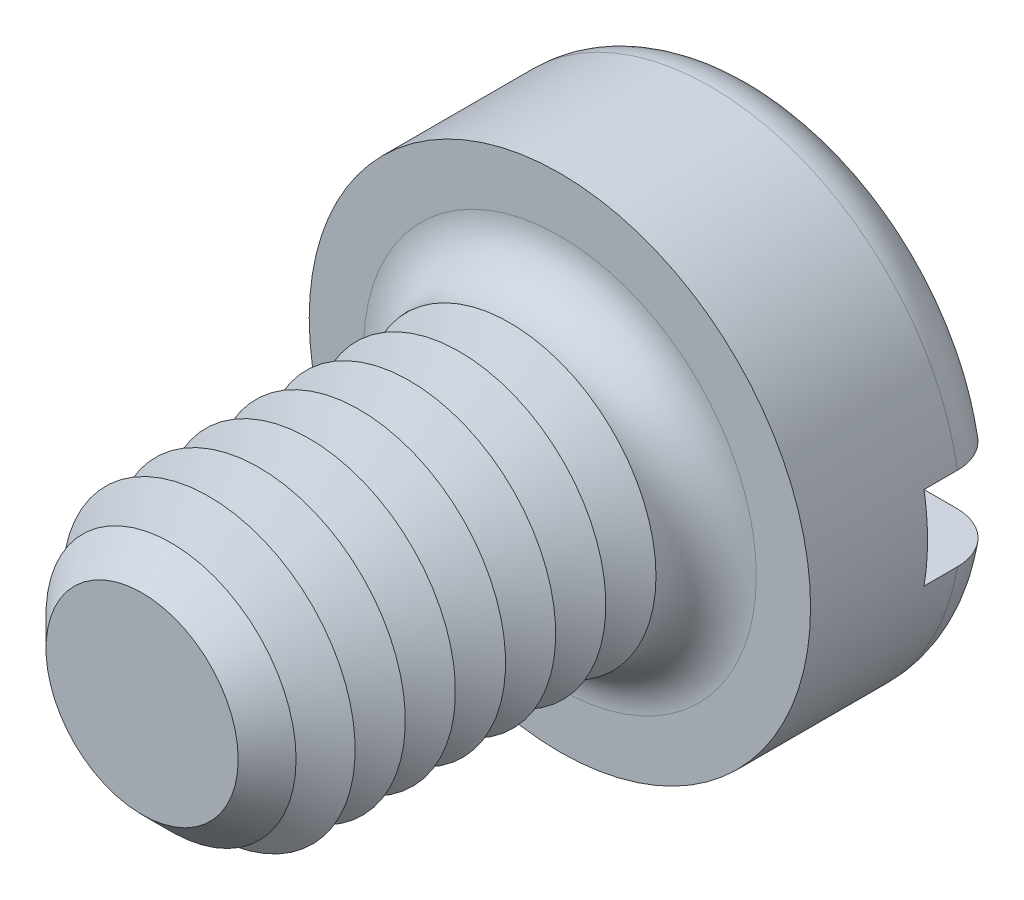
SolidWorks part; units mm, degrees
ref_plane "Front Plane" through (0, 0, 0) normal (0, 0, 1) x (1, 0, 0)
ref_plane "Top Plane" through (0, 0, 0) normal (0, 1, 0) x (1, 0, 0)
ref_plane "Right Plane" through (0, 0, 0) normal (1, 0, 0) x (0, 0, -1)
sketch "Sketch3" plane through (0, 0, 0) normal (0, 0, 1) x (1, 0, 0)
  circle A0 centre (0, 0) radius 3
  dimension "D1" = 6
extrude "Boss-Extrude2" add sketch "Sketch3" against normal blind 2.4
sketch "Sketch4" plane through (0, 0, 0) normal (0, 0, 1) x (1, 0, 0)
  circle A0 centre (0, 0) radius 1.75
  dimension "D1" = 3.5
extrude "Boss-Extrude3" add sketch "Sketch4" along normal blind 5
fillet "Fillet1" radius 0.6 2 edges at (3, 0, -2.4) (1.75, 0, 0)
chamfer "Chamfer1" distance 0.6 angle 45 1 edges at (1.75, 0, 5)
sketch "Sketch5" plane through (0, 0, 0) normal (1, 0, 0) x (0, 0, -1)
  line L0 (1.6944, 0) -> (-7.6738, 0) construction
sketch "Sketch6" plane through (0, 0, 0) normal (1, 0, 0) x (0, 0, -1)
  line L0 (-0.6, 1.75) -> (-0.9, 1.2304)
  line L1 (-0.9, 1.2304) -> (-1.2, 1.75)
  line L2 (-0.6, 1.75) -> (-4.4, 1.75) construction
  line L3 (-1.2, 1.75) -> (-0.6, 1.75)
  dimension "D1" = 0.6
revolve "Cut-Revolve1" cut sketch "Sketch6" angle 360 about L0
pattern_linear "LPattern1" count 7 spacing 0.6 along (0, 0, 1) of "Cut-Revolve1"
sketch "Sketch8" plane through (0, 0, -2.4) normal (0, 0, -1) x (-1, 0, 0)
  line L1 (3, -0.5) -> (-3, -0.5)
  line L2 (3, -0.5) -> (3, 0.5)
  line L3 (3, 0.5) -> (-3, 0.5)
  line L4 (-3, -0.5) -> (-3, 0.5)
  line L5 (3, -0.5) -> (-3, 0.5) construction
  line L6 (3, 0.5) -> (-3, -0.5) construction
  point P0 (0, 0)
  dimension "D1" = 6
  dimension "D2" = 1
extrude "Cut-Extrude1" cut sketch "Sketch8" against normal blind 1
